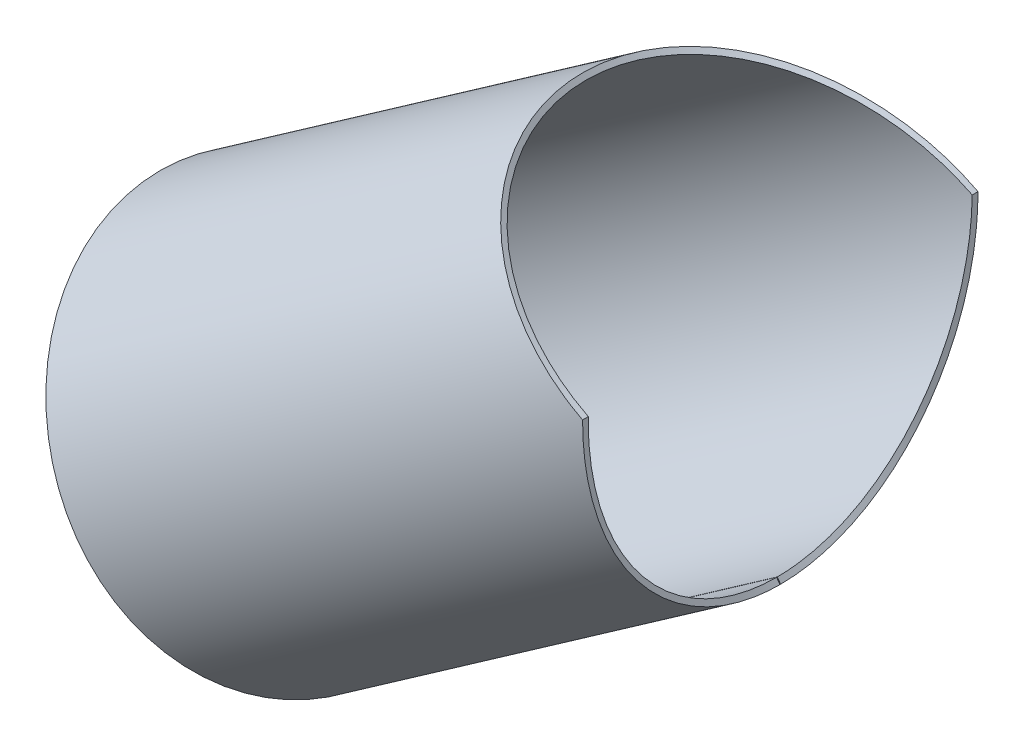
SolidWorks part; units mm, degrees
ref_plane "前视基准面" through (0, 0, 0) normal (0, 0, 1) x (1, 0, 0)
ref_plane "上视基准面" through (0, 0, 0) normal (0, 1, 0) x (1, 0, 0)
ref_plane "右视基准面" through (0, 0, 0) normal (1, 0, 0) x (0, 0, -1)
imported_body "基体零件-Y形补料管-1"
sheet metal parameters "钣金1" parameters "D1"=0.7366, "厚度"=8
bend "圆角折弯1" bend radius 267 bend angle 359.792 parameters "D5"=1
flatten bends "展开-折弯1"
sketch "尖角-草图1" plane through (-273.3687, -527.1273, -0.5) normal (0.5736, -0.8192, -0.0018) x (0.8192, 0.5736, 0.0013)
  line L0 (332.6541, -838.744) -> (-334.7886, -837.8942) construction
  dimension "D1" = 0
process bends "加工-折弯1" parameters "D1"=0
sketch "平面-草图1" plane through (-273.3687, -527.1273, -0.5) normal (0.5736, -0.8192, -0.0018) x (0.8192, 0.5736, 0.0013)
